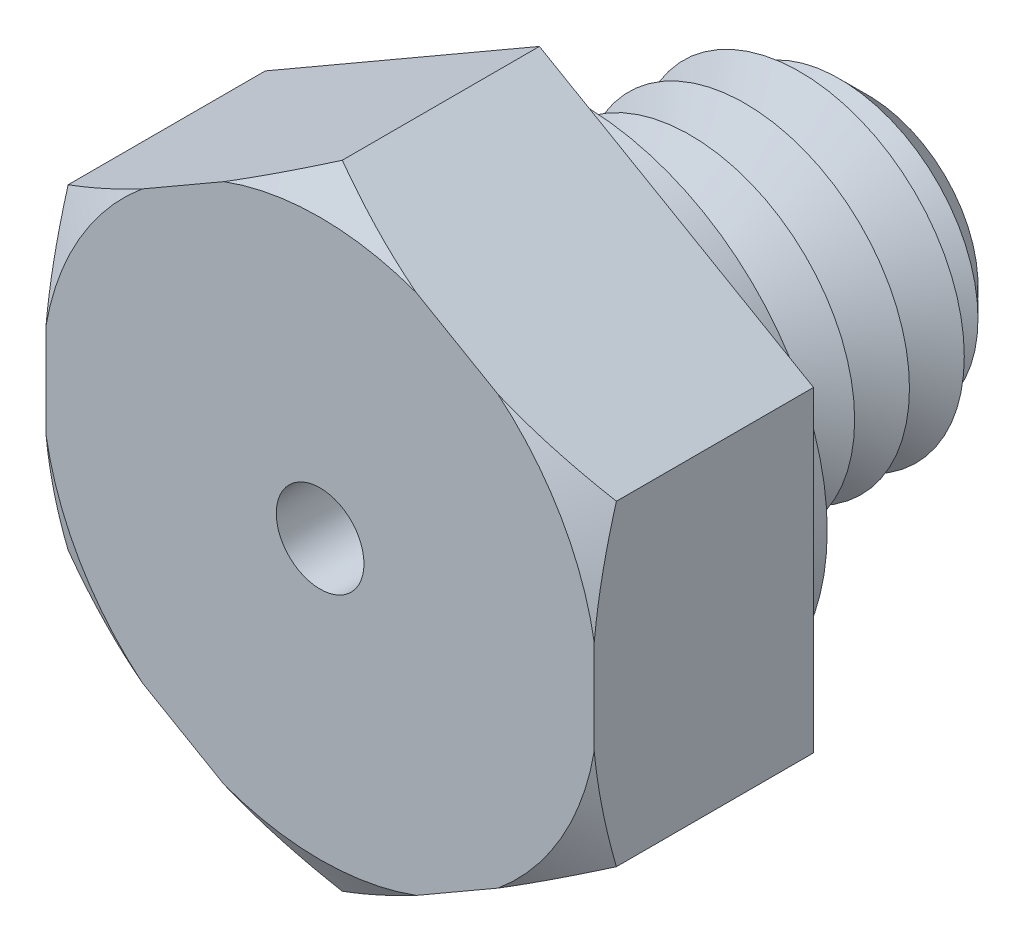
SolidWorks part; units mm, degrees
ref_plane "Front Plane" through (0, 0, 0) normal (0, 0, 1) x (1, 0, 0)
ref_plane "Top Plane" through (0, 0, 0) normal (0, 1, 0) x (1, 0, 0)
ref_plane "Right Plane" through (0, 0, 0) normal (1, 0, 0) x (0, 0, -1)
sketch "Sketch2" plane through (0, 0, 0) normal (0, 0, 1) x (1, 0, 0)
  line L1 (0, 5.7735) -> (-5, 2.8868)
  line L2 (-5, 2.8868) -> (-5, -2.8868)
  line L3 (-5, -2.8868) -> (0, -5.7735)
  line L4 (0, -5.7735) -> (5, -2.8868)
  line L5 (5, -2.8868) -> (5, 2.8868)
  line L6 (5, 2.8868) -> (0, 5.7735)
  circle A0 centre (0, 0) radius 5 construction
  dimension "D1" = 10
extrude "Boss-Extrude1" add sketch "Sketch2" along normal blind 4
sketch "Sketch3" plane through (0, 0, 0) normal (0, 0, -1) x (-1, 0, 0)
  circle A0 centre (0, 0) radius 3
  dimension "D1" = 6
extrude "Boss-Extrude2" add sketch "Sketch3" along normal blind 6
sketch "Sketch4" plane through (0, 0, 0) normal (0, 0, -1) x (-1, 0, 0)
  circle A0 centre (0, 0) radius 4.5
  dimension "D1" = 9
extrude "Boss-Extrude3" add sketch "Sketch4" along normal blind 0.75
sketch "Sketch5" plane through (0, 0, 0) normal (1, 0, 0) x (0, 0, -1)
  line L0 (-3.2117, 0) -> (6.3192, 0) construction
chamfer "Chamfer1" distance 1 angle 45 1 edges at (-3, 0, -6)
sketch "Sketch6" plane through (0, 0, 0) normal (1, 0, 0) x (0, 0, -1)
  line L0 (0.75, 3) -> (1.25, 2.134)
  line L1 (1.25, 2.134) -> (1.75, 3)
  line L2 (5, 3) -> (0.75, 3) construction
  line L3 (1.75, 3) -> (0.75, 3)
  dimension "D1" = 1
revolve "Cut-Revolve1" cut sketch "Sketch6" angle 360 about L0
pattern_linear "LPattern1" count 5 spacing 1 along (0, 0, -1) of "Cut-Revolve1"
sketch "Sketch7" plane through (0, 0, 0) normal (1, 0, 0) x (0, 0, -1)
  line L0 (-4, 5.7735) -> (-4, 5.0735)
  line L1 (-4, 2.8868) -> (-4, 5.7735) construction
  line L2 (-4, 5.0735) -> (-3.5959, 5.7735)
  line L3 (-4, 5.7735) -> (0, 5.7735) construction
  line L4 (-3.5959, 5.7735) -> (-4, 5.7735)
  dimension "D1" = 0.7
  dimension "D2" = 30
revolve "Cut-Revolve2" cut sketch "Sketch7" angle 360 about L0
sketch "Sketch8" plane through (0, 0, 4) normal (0, 0, 1) x (1, 0, 0)
  circle A0 centre (0, 0) radius 0.8
  dimension "D1" = 1.6
extrude "Cut-Extrude1" cut sketch "Sketch8" against normal up to surface (10 mm away)
